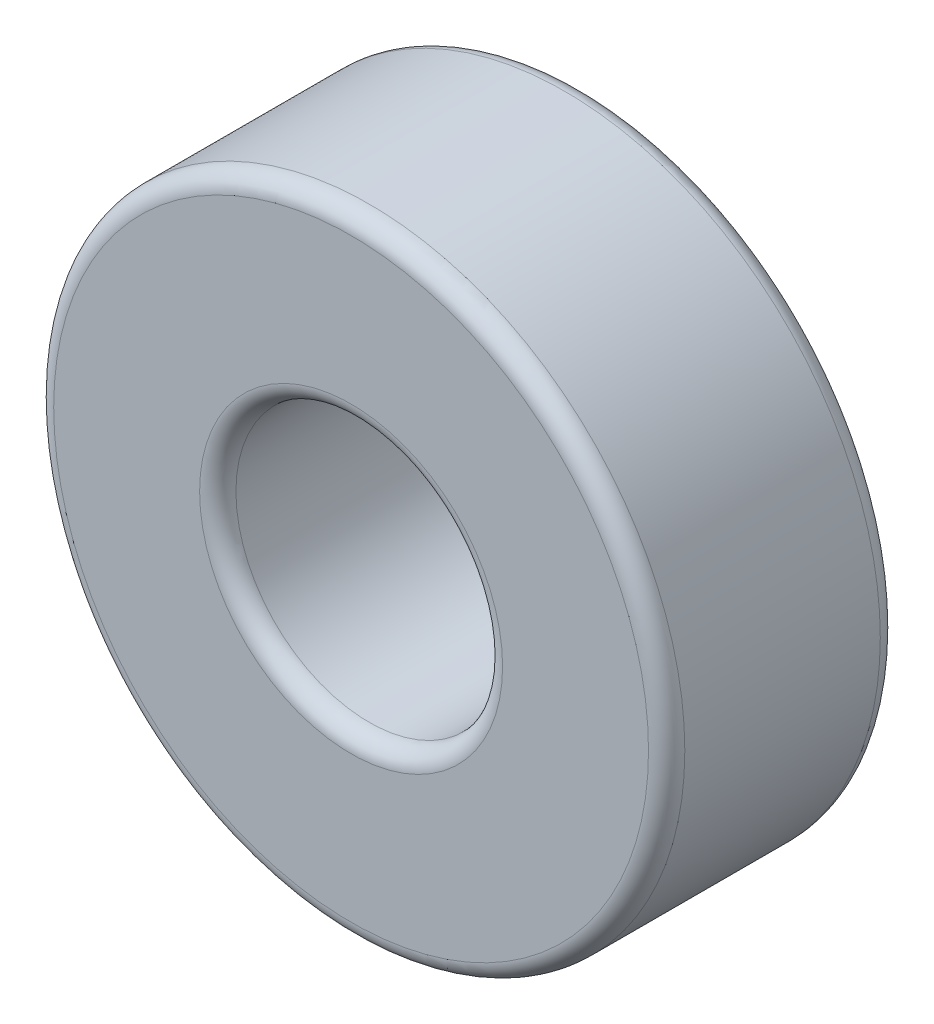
SolidWorks part; units mm, degrees
ref_plane "Front Plane" through (0, 0, 0) normal (0, 0, 1) x (1, 0, 0)
ref_plane "Top Plane" through (0, 0, 0) normal (0, 1, 0) x (1, 0, 0)
ref_plane "Right Plane" through (0, 0, 0) normal (1, 0, 0) x (0, 0, -1)
sketch "Sketch1" plane through (0, 0, 0) normal (0, 0, 1) x (1, 0, 0)
  circle A0 centre (0, 0) radius 9.55
  circle A1 centre (0, 0) radius 22.6
  dimension "D1" = 19.1
  dimension "D2" = 45.2
extrude "Main Extrude" add sketch "Sketch1" along normal mid plane 16.6 contours A1 A0
fillet "Fillets" radius 1.3 4 edges at (9.55, 0, -8.3) (9.55, 0, 8.3) (22.6, 0, 8.3) (22.6, 0, -8.3)
